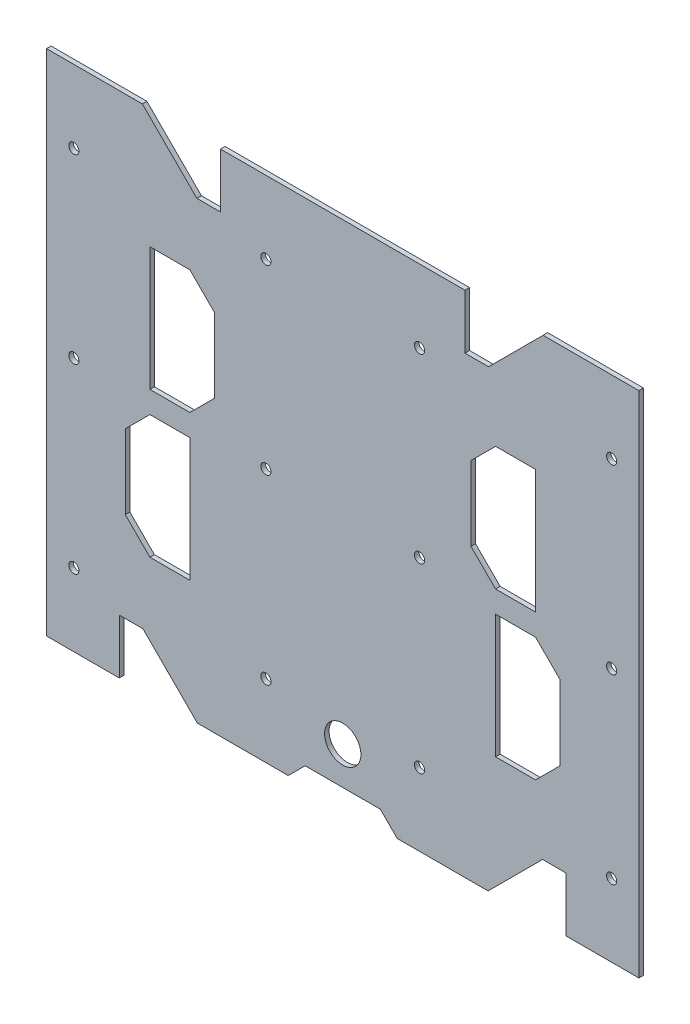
SolidWorks part; units mm, degrees
ref_plane "Front Plane" through (0, 0, 0) normal (0, 0, 1) x (1, 0, 0)
ref_plane "Top Plane" through (0, 0, 0) normal (0, 1, 0) x (1, 0, 0)
ref_plane "Right Plane" through (0, 0, 0) normal (1, 0, 0) x (0, 0, -1)
sketch "Sketch2" plane through (0, 0, 0) normal (0, 0, 1) x (1, 0, 0)
  line L1 (-103.505, -88.9) -> (103.505, -88.9)
  line L2 (-103.505, -88.9) -> (-103.505, 88.9)
  line L3 (-103.505, 88.9) -> (103.505, 88.9)
  line L4 (103.505, -88.9) -> (103.505, 88.9)
  line L5 (0, 88.9) -> (0, -88.9) construction
  line L6 (-103.505, 0) -> (103.505, 0) construction
  point P0 (0, 0)
  dimension "D1" = 207.01
  dimension "D2" = 177.8
base flange "Base-Flange1" sketch "Sketch2" thickness 1.5875 reverse thickness direction no parameters "D1"=0.7366
sketch "Sketch18" plane through (0, 0, 0) normal (0, 0, 1) x (1, 0, 0)
  line L0 (-26.8478, 88.9) -> (-26.8478, -88.9) construction
  line L1 (-103.505, 88.9) -> (103.505, 88.9) construction
  line L2 (-103.505, -88.9) -> (103.505, -88.9) construction
  line L3 (-103.505, 88.9) -> (-103.505, -88.9) construction
  line L4 (-93.98, 88.9) -> (-93.98, -88.9) construction
  line L5 (103.505, 88.9) -> (-103.505, 88.9) construction
  line L6 (0, 0) -> (103.505, 0) construction
  line L7 (103.505, -88.9) -> (103.505, 88.9) construction
  line L8 (0, 0) -> (0, 88.9) construction
  line L9 (26.8478, 88.9) -> (26.8478, -88.9) construction
  line L10 (93.98, 88.9) -> (93.98, -88.9) construction
  line L11 (-78.105, 88.9) -> (-78.105, -88.9) construction
  line L12 (-42.7228, 88.9) -> (-42.7228, -88.9) construction
  circle A0 centre (-26.8478, 63.5) radius 1.778
  circle A1 centre (-26.8478, 0) radius 1.778
  circle A2 centre (-26.8478, -63.5) radius 1.778
  circle A3 centre (-93.98, 63.5) radius 1.778
  circle A4 centre (-93.98, 0) radius 1.778
  circle A5 centre (-93.98, -63.5) radius 1.778
  circle A6 centre (93.98, -63.5) radius 1.778
  circle A7 centre (26.8478, -63.5) radius 1.778
  circle A8 centre (26.8478, 0) radius 1.778
  circle A9 centre (93.98, 0) radius 1.778
  circle A10 centre (26.8478, 63.5) radius 1.778
  circle A11 centre (93.98, 63.5) radius 1.778
  point P18 (0, 44.45)
  point P52 (26.8478, 63.5)
  point P53 (26.8478, 0)
  point P54 (-26.8478, 0)
  point P55 (-26.8478, -63.5)
  point P56 (26.8478, -63.5)
  dimension "D3" = 3.556
  dimension "D5" = 35.3822
  dimension "D1" = 15.875
  dimension "D2" = 9.525
  dimension "D4" = 63.5
  dimension "D6" = 15.875
extrude "Cut-Extrude2" cut sketch "Sketch18" against normal blind 4.7625
sketch "Sketch19" plane through (0, 0, 0) normal (0, 0, 1) x (1, 0, 0)
  line L0 (-53.4289, 46.99) -> (-44.8246, 38.3857)
  line L1 (-78.105, 88.9) -> (-78.105, -88.9) construction
  line L2 (-78.105, 88.9) -> (-78.105, -88.9) construction
  line L3 (-67.3989, 46.99) -> (-53.4289, 46.99)
  line L4 (-39.5478, 88.9) -> (-39.5478, -88.9) construction
  line L5 (-42.7228, -88.9) -> (-42.7228, 88.9) construction
  line L10 (-42.7228, -88.9) -> (-42.7228, 88.9) construction
  line L24 (-67.3989, 46.99) -> (-67.3989, 3.81)
  line L25 (-67.3989, 3.81) -> (-53.4289, 3.81)
  line L27 (-53.4289, 46.99) -> (-53.4289, 3.81) construction
  line L28 (-44.8246, 38.3857) -> (-44.8246, 12.4143)
  line L40 (-44.8246, 12.4143) -> (-53.4289, 3.81)
  line L43 (-67.3989, -3.81) -> (-76.0031, -12.4143)
  line L45 (-76.0031, -12.4143) -> (-76.0031, -38.3857)
  line L47 (-76.0031, -38.3857) -> (-67.3989, -46.99)
  line L49 (-67.3989, -46.99) -> (-53.4289, -46.99)
  line L52 (-53.4289, -46.99) -> (-53.4289, -3.81)
  line L53 (0, 88.9) -> (0, -88.9) construction
  line L54 (103.505, 88.9) -> (-103.505, 88.9) construction
  line L55 (-103.505, -88.9) -> (103.505, -88.9) construction
  line L140 (-53.4289, -3.81) -> (-67.3989, -3.81)
  line L143 (-60.4139, 41.4429) -> (-60.4139, 39.9457) construction
  line L144 (-87.0839, 28.575) -> (-87.0839, 22.225) construction
  line L145 (-87.0839, 28.575) -> (-87.0839, 22.225) construction
  line L146 (0, 0) -> (-103.505, 0) construction
  line L147 (-103.505, 88.9) -> (-103.505, -88.9) construction
  line L148 (-78.105, -88.9) -> (-78.105, -69.85)
  line L149 (-78.105, -69.85) -> (-69.85, -69.85)
  line L150 (-69.85, -69.85) -> (-50.8, -88.9)
  line L151 (-103.505, -88.9) -> (103.505, -88.9) construction
  line L152 (-50.8, -88.9) -> (-78.105, -88.9)
  line L157 (50.8, -88.9) -> (78.105, -88.9)
  line L158 (69.85, -69.85) -> (50.8, -88.9)
  line L159 (78.105, -69.85) -> (69.85, -69.85)
  line L160 (78.105, -88.9) -> (78.105, -69.85)
  line L161 (53.4289, 46.99) -> (53.4289, 3.81) construction
  line L166 (53.4289, -3.81) -> (67.3989, -3.81)
  line L167 (53.4289, -46.99) -> (53.4289, -3.81)
  line L168 (67.3989, -46.99) -> (53.4289, -46.99)
  line L169 (76.0031, -38.3857) -> (67.3989, -46.99)
  line L170 (76.0031, -12.4143) -> (76.0031, -38.3857)
  line L171 (67.3989, -3.81) -> (76.0031, -12.4143)
  line L172 (44.8246, 12.4143) -> (53.4289, 3.81)
  line L173 (44.8246, 38.3857) -> (44.8246, 12.4143)
  line L174 (67.3989, 3.81) -> (53.4289, 3.81)
  line L175 (67.3989, 46.99) -> (67.3989, 3.81)
  line L176 (67.3989, 46.99) -> (53.4289, 46.99)
  line L177 (53.4289, 46.99) -> (44.8246, 38.3857)
  line L178 (-42.7228, 88.9) -> (-42.7228, 69.85)
  line L179 (-42.7228, 69.85) -> (-50.9778, 69.85)
  line L180 (-50.9778, 69.85) -> (-70.0278, 88.9)
  line L181 (-70.0278, 88.9) -> (-42.7228, 88.9)
  line L182 (42.7228, 69.85) -> (50.9778, 69.85)
  line L183 (42.7228, 88.9) -> (42.7228, 69.85)
  line L184 (70.0278, 88.9) -> (42.7228, 88.9)
  line L185 (50.9778, 69.85) -> (70.0278, 88.9)
  line L186 (-19.05, -88.9) -> (-13.1383, -82.9883)
  line L187 (-13.1383, -82.9883) -> (13.1383, -82.9883)
  line L188 (13.1383, -82.9883) -> (19.05, -88.9)
  line L189 (-19.05, -88.9) -> (19.05, -88.9)
  point P16 (-60.4139, 46.99)
  point P19 (-60.4139, -3.81)
  point P20 (-60.4139, 40.6943)
  point P21 (-87.0839, 25.4)
  point P24 (-67.3989, 25.4)
  point P25 (-53.4289, -25.4)
  point P40 (-60.4139, 3.81)
  point P68 (60.4139, 3.81)
  point P71 (53.4289, -25.4)
  point P72 (60.4139, -3.81)
  point P75 (0, -82.9883)
  dimension "D1" = 43.18
  dimension "D2" = 13.97
  dimension "D3" = 45
  dimension "D4" = 8.89
  dimension "D5" = 8.255
  dimension "D6" = 19.05
  dimension "D7" = 38.1
extrude "Cut-Extrude3" cut sketch "Sketch19" against normal through all
sketch "Sketch20" plane through (0, 0, 0) normal (0, 0, 1) x (1, 0, 0)
  circle A3 centre (0, -69.85) radius 6.35 construction
  circle A4 centre (0, -69.85) radius 6.35
extrude "Cut-Extrude4" cut sketch "Sketch20" against normal blind 2.54 and the other way through all
sketch "Bend-Lines1" [suppressed] plane through (0, 0, 0) normal (0, 1, 0) x (1, 0, 0)
sketch "Bounding-Box1" [suppressed] plane through (0, 0, 0) normal (0, 1, 0) x (1, 0, 0)
sheet metal parameters "Sheet-Metal1" thickness 1.5875 parameters "D1"=0.7366
flat pattern "Flat-Pattern1"
sketch "Bend-Lines2" plane through (0, 0, 0) normal (0, 1, 0) x (1, 0, 0)
sketch3d "Bounding-Box2" [suppressed]
  line L0 (81.28, 101.6, 0) -> (81.28, -101.6, 0) construction
  line L1 (-81.28, 101.6, 0) -> (-81.28, -101.6, 0) construction
  line L2 (81.28, 101.6, 0) -> (-81.28, 101.6, 0) construction
  line L3 (81.28, -101.6, 0) -> (-81.28, -101.6, 0) construction
sheet metal parameters "Sheet-Metal4" thickness 1.5875 parameters "D1"=0.7366
flat pattern "Flat-Pattern1"
sketch "Bend-Lines2" plane through (0, 0, 0) normal (0, 1, 0) x (1, 0, 0)
sketch3d "Bounding-Box2" [suppressed]
  line L0 (-106.68, -101.6, 0) -> (106.68, -101.6, 0) construction
  line L1 (-106.68, 101.6, 0) -> (106.68, 101.6, 0) construction
  line L2 (-106.68, -101.6, 0) -> (-106.68, 101.6, 0) construction
  line L3 (106.68, -101.6, 0) -> (106.68, 101.6, 0) construction
sheet metal parameters "Sheet-Metal5" thickness 1.5875 parameters "D1"=0.7366
flat pattern "Flat-Pattern1"
sketch "Bend-Lines2" plane through (0, 0, 0) normal (0, 1, 0) x (1, 0, 0)
sketch3d "Bounding-Box2" [suppressed]
  line L0 (-100.33, -88.9, 0) -> (100.33, -88.9, 0) construction
  line L1 (-100.33, 88.9, 0) -> (100.33, 88.9, 0) construction
  line L2 (-100.33, -88.9, 0) -> (-100.33, 88.9, 0) construction
  line L3 (100.33, -88.9, 0) -> (100.33, 88.9, 0) construction
sheet metal parameters "Sheet-Metal6" thickness 1.5875 parameters "D1"=0.7366
flat pattern "Flat-Pattern1"
sketch "Bend-Lines2" plane through (0, 0, 0) normal (0, 1, 0) x (1, 0, 0)
sketch3d "Bounding-Box2" [suppressed]
  line L0 (-103.505, -88.9, 0) -> (103.505, -88.9, 0) construction
  line L1 (-103.505, 88.9, 0) -> (103.505, 88.9, 0) construction
  line L2 (-103.505, -88.9, 0) -> (-103.505, 88.9, 0) construction
  line L3 (103.505, -88.9, 0) -> (103.505, 88.9, 0) construction
